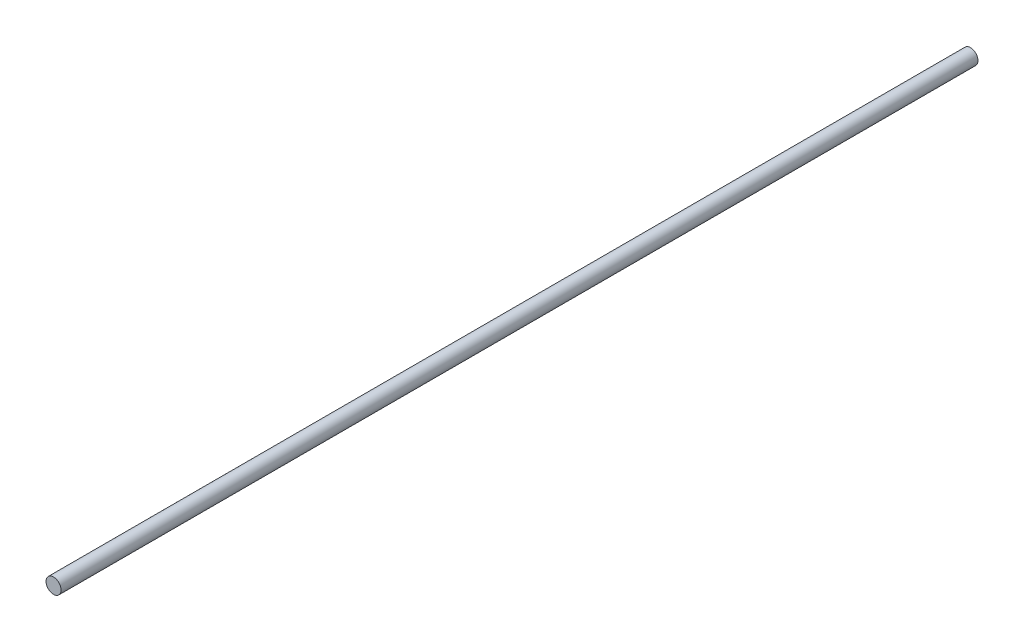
SolidWorks part; units mm, degrees
ref_plane "Front Plane" through (0, 0, 0) normal (0, 0, 1) x (1, 0, 0)
ref_plane "Top Plane" through (0, 0, 0) normal (0, 1, 0) x (1, 0, 0)
ref_plane "Right Plane" through (0, 0, 0) normal (1, 0, 0) x (0, 0, -1)
sketch "Sketch1" plane through (0, 0, 0) normal (0, 0, 1) x (1, 0, 0)
  circle A0 centre (0, 0) radius 30
  dimension "D1" = 60
extrude "Boss-Extrude1" add sketch "Sketch1" against normal blind 3650
